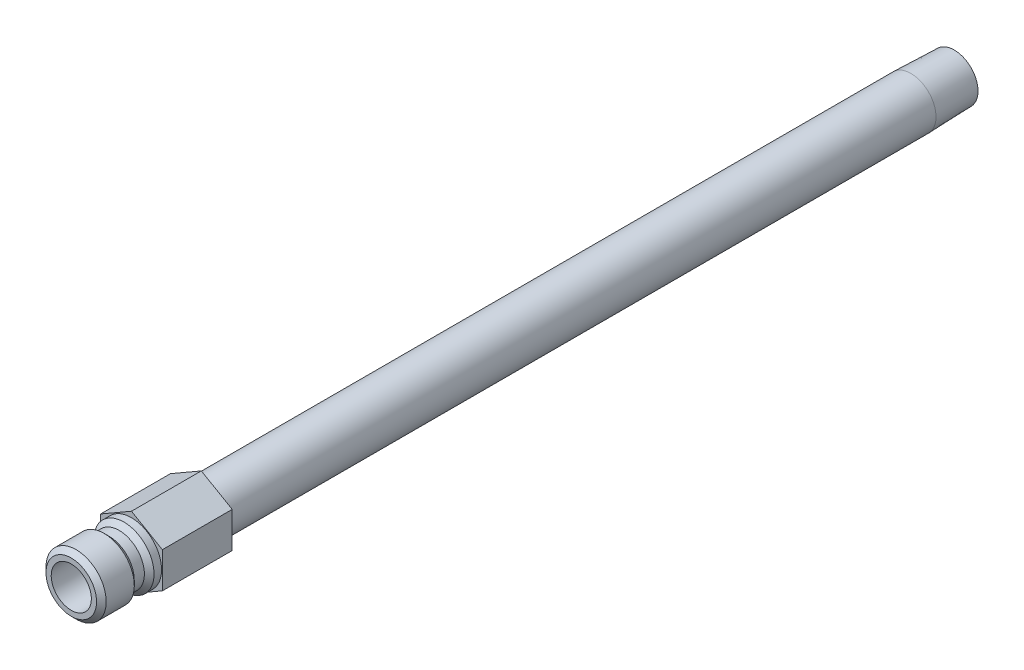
SolidWorks part; units mm, degrees
ref_plane "Front Plane" through (0, 0, 0) normal (0, 0, 1) x (1, 0, 0)
ref_plane "Top Plane" through (0, 0, 0) normal (0, 1, 0) x (1, 0, 0)
ref_plane "Right Plane" through (0, 0, 0) normal (1, 0, 0) x (0, 0, -1)
sketch "Sketch1" plane through (0, 0, 0) normal (1, 0, 0) x (0, 0, -1)
  line L0 (0, 0) -> (-12.7, 0) construction
  line L1 (-9.525, 3.175) -> (-9.525, 4.0005)
  line L2 (-3.556, 4.0005) -> (-3.556, 0) construction
  line L3 (-8.763, 4.7625) -> (-4.318, 4.7625)
  line L4 (0, 3.9688) -> (0, 3.175) construction
  line L5 (-3.556, 4.0005) -> (-1.9558, 4.0005)
  line L6 (-1.1938, 4.7625) -> (0, 4.7625)
  line L7 (0, 4.7625) -> (0, 3.9688)
  line L8 (-3.556, 4.0005) -> (-4.318, 4.7625)
  line L9 (-1.9558, 4.0005) -> (-1.1938, 4.7625)
  line L10 (-9.525, 4.0005) -> (-8.763, 4.7625)
  line L11 (0.127, 3.175) -> (0.127, 2.3813)
  line L12 (0, 3.9688) -> (123.317, 3.9688)
  line L13 (123.317, 3.9688) -> (130.175, 3.7544)
  line L14 (130.175, 3.7544) -> (130.175, 2.3813)
  line L15 (0, 0) -> (11.049, 0) construction
  line L16 (11.049, 0) -> (11.049, 4.7625) construction
  line L17 (11.049, 4.7625) -> (0, 4.7625) construction
  line L19 (0.127, 3.175) -> (-9.525, 3.175)
  line L20 (0.127, 2.3813) -> (130.175, 2.3813)
  line L21 (0, 2.6543) -> (0, 0) construction
  dimension "D1" = 9.525
  dimension "D2" = 1.6002
  dimension "D3" = 0.762
  dimension "D4" = 45
  dimension "D5" = 5.969
  dimension "D6" = 45
  dimension "D7" = 1.79
  dimension "D8" = 6.858
  dimension "D9" = 139.7
  dimension "D10" = 3.175
  dimension "D11" = 20.574
  dimension "D12" = 6.35
  dimension "D13" = 4.7625
  dimension "D14" = 9.525
  dimension "D15" = 7.9375
  dimension "D16" = 9.652
revolve "Revolve1" add sketch "Sketch1" angle 360 about L0
sketch "Sketch2" plane through (0, 0, 0) normal (0, 0, 1) x (1, 0, 0)
  line L1 (-4.8895, 2.823) -> (-4.8895, -2.823)
  line L2 (-4.8895, -2.823) -> (0, -5.6459)
  line L3 (0, -5.6459) -> (4.8895, -2.823)
  line L4 (4.8895, -2.823) -> (4.8895, 2.823)
  line L5 (4.8895, 2.823) -> (0, 5.6459)
  line L6 (0, 5.6459) -> (-4.8895, 2.823)
  circle A0 centre (0, 0) radius 4.8895 construction
  circle A1 centre (0, 0) radius 2.3812 construction
  circle A2 centre (0, 0) radius 2.3812
  dimension "D1" = 9.779
extrude "Boss-Extrude1" add sketch "Sketch2" against normal up to vertex (11.049 mm away) from vertex at 0
